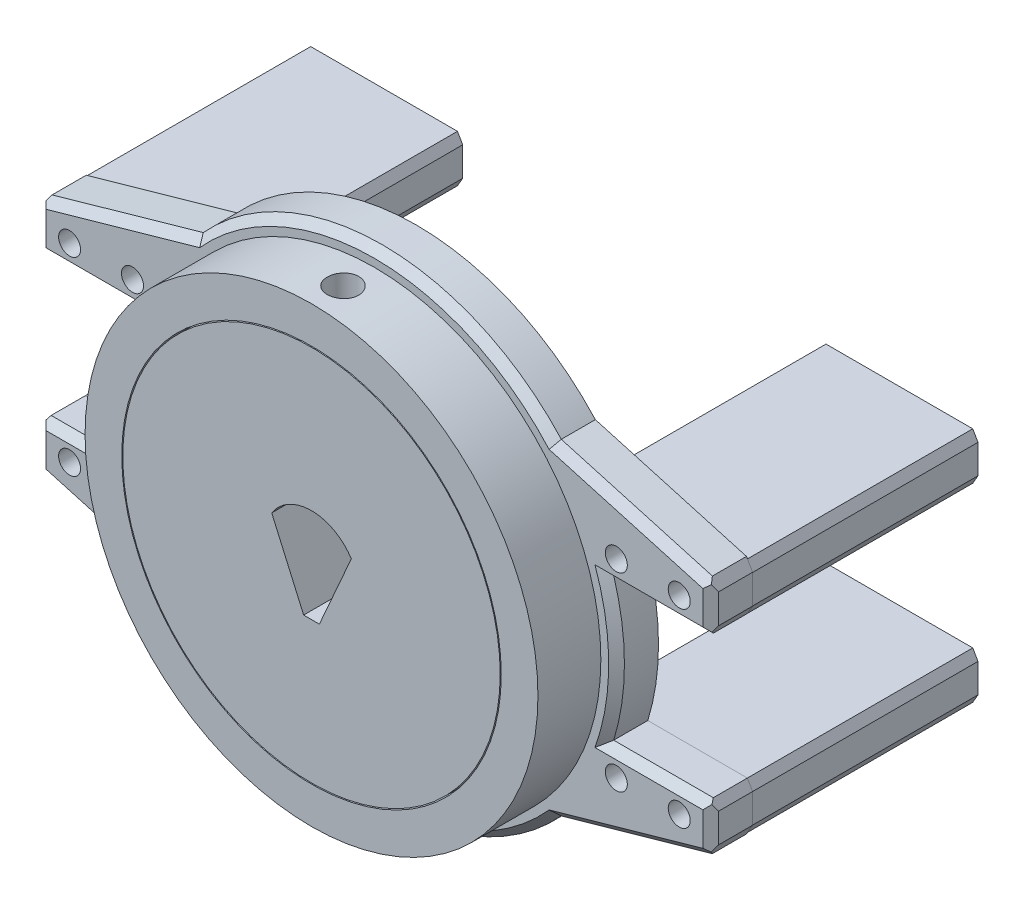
SolidWorks part; units mm, degrees
other "Holder"
other "Die" parameters "D2"=10.3654, "D4"=73.0293, "D1"=11.373, "D3"=41.0446, "D5"=28, "D6"=60.0193, "D7"=4
ref_plane "Top Plane" through (0, 0, 0) normal (0, 0, 1) x (1, 0, 0)
ref_plane "Front Plane" through (0, 0, 0) normal (0, 1, 0) x (1, 0, 0)
ref_plane "Right Plane" through (0, 0, 0) normal (1, 0, 0) x (0, 0, -1)
sketch "Sketch2" plane through (0, 0, 0) normal (0, 0, 1) x (1, 0, 0)
  line L0 (-3.8311, 0) -> (3.8311, 0) construction
  line L1 (0, 0) -> (0, 9) construction
  line L2 (0, 0) -> (-7.5919, 4.8335) construction
  line L6 (0, 0) -> (7.5919, 4.8335) construction
  line L7 (-7.5919, 4.8335) -> (-1.5, -9)
  line L8 (-1.5, -9) -> (1.5, -9)
  line L9 (1.5, -9) -> (7.5919, 4.8335)
  line L10 (0, 0) -> (0, -9) construction
  circle A0 centre (0, 0) radius 5 construction
  circle A2 centre (0, 0) radius 36
  arc A3 (0, 9) -> (7.5919, 4.8335) centre (0, 0) cw
  arc A4 (-7.5919, 4.8335) -> (0, 9) centre (0, 0) cw
  point P3 (0, -9)
  point P6 (0, 0)
  point P11 (28.1431, -6.9977)
  point P12 (28.1374, -7.0206)
  point P16 (0, 0)
  point P17 (26.8284, -11.0108)
extrude "Boss-Extrude1" add sketch "Sketch2" along normal blind 12
sketch "Sketch3" plane through (0, 0, 0) normal (0, 1, 0) x (1, 0, 0)
  line L0 (-36, -12) -> (36, -12) construction
  line L1 (36, 0) -> (-36, 0) construction
  line L2 (-36, -12) -> (36, -12) construction
  line L3 (36, 0) -> (-36, 0) construction
  line L4 (0, 0) -> (0, -12) construction
  circle A0 centre (0, -6) radius 2.6
  point P8 (0, -12)
extrude "Cut-Extrude1" cut sketch "Sketch3" along normal up to surface (36 mm away)
sketch "Sketch4" plane through (0, 0, 0) normal (0, 0, -1) x (-1, 0, 0)
  circle A0 centre (0, 0) radius 36 construction
  circle A1 centre (0, 0) radius 36
  circle A2 centre (0, 0) radius 36.2
  circle A3 centre (0, 0) radius 43.2
extrude "Boss-Extrude2" add sketch "Sketch4" against normal up to surface (12 mm away) separate body contours A3 A2
sketch "Sketch5" plane through (0, 0, 0) normal (0, 1, 0) x (1, 0, 0)
  circle A0 centre (0, -6) radius 2.6 construction
  circle A1 centre (0, -6) radius 2.6 construction
  circle A2 centre (0, -6) radius 3
extrude "Cut-Extrude2" cut sketch "Sketch5" along normal up to surface (43.2 mm away)
sketch "Sketch6" plane through (0, 0, 0) normal (0, 0, -1) x (-1, 0, 0)
  line L0 (42.6, 0) -> (-42.6, 0) construction
  line L1 (42.6, 0) -> (42.6, -13.6) construction
  line L2 (42.6, 0) -> (42.6, 13.6) construction
  line L3 (42.6, -13.6) -> (44.1529, -13.6) construction
  line L4 (42.6, 13.6) -> (44.1529, 13.6) construction
  line L5 (44.1529, -13.6) -> (64.1529, -13.6)
  line L6 (64.1529, -13.6) -> (64.1529, -22.6)
  line L7 (64.1529, -22.6) -> (34.1529, -31.113)
  line L8 (44.1529, 13.6) -> (64.1529, 13.6)
  line L9 (64.1529, 13.6) -> (64.1529, 22.6)
  line L10 (64.1529, 22.6) -> (34.1529, 31.113)
  line L11 (34.1529, -31.113) -> (34.1529, 31.113) construction
  line L12 (0, -58.262) -> (0, 58.262) construction
  line L13 (-64.1529, 22.6) -> (-34.1529, 31.113)
  line L14 (-64.1529, 13.6) -> (-64.1529, 22.6)
  line L15 (-44.1529, 13.6) -> (-64.1529, 13.6)
  line L16 (-44.1529, -13.6) -> (-64.1529, -13.6)
  line L17 (-64.1529, -13.6) -> (-64.1529, -22.6)
  line L18 (-64.1529, -22.6) -> (-34.1529, -31.113)
  arc A0 (34.1529, 31.113) -> (-34.1529, 31.113) centre (0, 0) ccw
  arc A1 (-44.1529, 13.6) -> (-44.1529, -13.6) centre (0, 0) ccw
  arc A2 (-34.1529, -31.113) -> (34.1529, -31.113) centre (0, 0) ccw
  circle A3 centre (0, 0) radius 46.2
  arc A4 (44.1529, -13.6) -> (44.1529, 13.6) centre (0, 0) ccw
  circle A7 centre (0, 0) radius 32
  circle A8 centre (0, 0) radius 32
  point P3 (0, 0)
  point P19 (0, 0)
extrude "Boss-Extrude3" add sketch "Sketch6" along normal blind 8
chamfer "Chamfer1" distance 1.5 angle 45 16 edges at (-49.1529, 26.8565, 0) (0, 46.2, 0) (49.1529, 26.8565, 0) (64.1529, 18.1, 0) (54.1529, 13.6, 0) (46.2, 0, 0) (54.1529, -13.6, 0) (64.1529, -18.1, 0) (49.1529, -26.8565, 0) (0, -46.2, 0) (-49.1529, -26.8565, 0) (-64.1529, -18.1, 0) (-54.1529, -13.6, 0) (-46.2, 0, 0) (-54.1529, 13.6, 0) (-64.1529, 18.1, 0)
sketch "Sketch7" plane through (0, 0, -8) normal (0, 0, -1) x (-1, 0, 0)
  line L0 (-64.1529, 13.6) -> (-44.1529, 13.6) construction
  line L1 (-63.1529, 22.6) -> (-35.1529, 22.6)
  line L2 (-64.1529, 20.8679) -> (-64.1529, 15.3321)
  line L3 (-63.1529, 13.6) -> (-35.1529, 13.6)
  line L4 (-34.1529, 20.8679) -> (-34.1529, 15.3321)
  line L5 (-64.1529, 22.6) -> (-64.1529, 13.6) construction
  line L6 (-64.1529, 22.6) -> (-64.1529, 13.6) construction
  line L7 (-64.1529, 22.6) -> (-6.4522, 22.6) construction
  line L8 (-64.1529, 18.1) -> (-34.1529, 18.1) construction
  line L9 (-64.1529, 20.8679) -> (-63.1529, 22.6)
  line L10 (-64.1529, 15.3321) -> (-63.1529, 13.6)
  line L11 (-35.1529, 13.6) -> (-34.1529, 15.3321)
  line L12 (-35.1529, 22.6) -> (-34.1529, 20.8679)
  line L13 (0, 54.9745) -> (0, -54.9745) construction
  line L14 (-78.161, 0) -> (78.161, 0) construction
  line L15 (35.1529, 13.6) -> (34.1529, 15.3321)
  line L16 (34.1529, 20.8679) -> (34.1529, 15.3321)
  line L17 (35.1529, 22.6) -> (34.1529, 20.8679)
  line L18 (63.1529, 13.6) -> (35.1529, 13.6)
  line L19 (64.1529, 15.3321) -> (63.1529, 13.6)
  line L20 (64.1529, 20.8679) -> (63.1529, 22.6)
  line L21 (63.1529, 22.6) -> (35.1529, 22.6)
  line L22 (64.1529, 20.8679) -> (64.1529, 15.3321)
  line L23 (-64.1529, -20.8679) -> (-63.1529, -22.6)
  line L24 (-64.1529, -20.8679) -> (-64.1529, -15.3321)
  line L25 (-64.1529, -15.3321) -> (-63.1529, -13.6)
  line L26 (-63.1529, -13.6) -> (-35.1529, -13.6)
  line L27 (-35.1529, -13.6) -> (-34.1529, -15.3321)
  line L28 (-34.1529, -20.8679) -> (-34.1529, -15.3321)
  line L29 (-35.1529, -22.6) -> (-34.1529, -20.8679)
  line L30 (-63.1529, -22.6) -> (-35.1529, -22.6)
  line L31 (64.1529, -20.8679) -> (64.1529, -15.3321)
  line L32 (63.1529, -22.6) -> (35.1529, -22.6)
  line L33 (64.1529, -20.8679) -> (63.1529, -22.6)
  line L34 (64.1529, -15.3321) -> (63.1529, -13.6)
  line L35 (63.1529, -13.6) -> (35.1529, -13.6)
  line L36 (35.1529, -22.6) -> (34.1529, -20.8679)
  line L37 (34.1529, -20.8679) -> (34.1529, -15.3321)
  line L38 (35.1529, -13.6) -> (34.1529, -15.3321)
  point P0 (-64.1529, 22.6)
  point P1 (-34.1529, 13.6)
  point P2 (-64.1529, 13.6)
  point P3 (-34.1529, 22.6)
  point P21 (-34.1529, 18.1)
  point P23 (-64.1529, 18.1)
  point P24 (0, 0)
  point P30 (0, 0)
  dimension "D1" = 30
  dimension "D2" = 1
  dimension "D3" = 60
  dimension "D4" = 1
  dimension "D5" = 60
  dimension "D6" = 1
  dimension "D7" = 60
  dimension "D8" = 1
  dimension "D9" = 60
extrude "Boss-Extrude4" add sketch "Sketch7" along normal blind 43 separate body
chamfer "Chamfer3" distance 1 angle 60 2 edges at (-64.1529, 13.6, -4.75) (64.1529, -13.6, -4.75)
chamfer "Chamfer4" distance 1.7 angle 30 4 edges at (-64.1529, 22.6, -4.75) (-64.1529, -13.6, -4.75) (64.1529, 13.6, -4.75) (64.1529, -22.6, -4.75)
chamfer "Chamfer5" distance 1.7 angle 30 1 edges at (-64.1529, -22.6, -4.75)
chamfer "Chamfer6" distance 1.7 angle 30 1 edges at (64.1529, 22.6, -4.75)
sketch "Sketch8" plane through (0, 0, -8) normal (0, 0, -1) x (-1, 0, 0)
  line L0 (64.1529, -20.8679) -> (63.1529, -22.6) construction
  line L1 (63.1529, -22.6) -> (35.1529, -22.6) construction
  line L2 (35.1529, -22.6) -> (34.1529, -20.8679) construction
  line L3 (34.1529, -20.8679) -> (34.1529, -15.3321) construction
  line L4 (34.1529, -15.3321) -> (35.1529, -13.6) construction
  line L5 (35.1529, -13.6) -> (63.1529, -13.6) construction
  line L6 (63.1529, -13.6) -> (64.1529, -15.3321) construction
  line L7 (64.1529, -15.3321) -> (64.1529, -20.8679) construction
  line L8 (63.1529, 13.6) -> (35.1529, 13.6) construction
  line L9 (35.1529, 13.6) -> (34.1529, 15.3321) construction
  line L10 (34.1529, 15.3321) -> (34.1529, 20.8679) construction
  line L11 (34.1529, 20.8679) -> (35.1529, 22.6) construction
  line L12 (35.1529, 22.6) -> (63.1529, 22.6) construction
  line L13 (63.1529, 22.6) -> (64.1529, 20.8679) construction
  line L14 (64.1529, 20.8679) -> (64.1529, 15.3321) construction
  line L15 (64.1529, 15.3321) -> (63.1529, 13.6) construction
  line L16 (-64.1529, 20.8679) -> (-63.1529, 22.6) construction
  line L17 (-63.1529, 22.6) -> (-35.1529, 22.6) construction
  line L18 (-35.1529, 22.6) -> (-34.1529, 20.8679) construction
  line L19 (-34.1529, 20.8679) -> (-34.1529, 15.3321) construction
  line L20 (-34.1529, 15.3321) -> (-35.1529, 13.6) construction
  line L21 (-35.1529, 13.6) -> (-63.1529, 13.6) construction
  line L22 (-63.1529, 13.6) -> (-64.1529, 15.3321) construction
  line L23 (-64.1529, 15.3321) -> (-64.1529, 20.8679) construction
  line L24 (-64.1529, -20.8679) -> (-64.1529, -15.3321) construction
  line L25 (-64.1529, -15.3321) -> (-63.1529, -13.6) construction
  line L26 (-63.1529, -13.6) -> (-35.1529, -13.6) construction
  line L27 (-35.1529, -13.6) -> (-34.1529, -15.3321) construction
  line L28 (-34.1529, -15.3321) -> (-34.1529, -20.8679) construction
  line L29 (-34.1529, -20.8679) -> (-35.1529, -22.6) construction
  line L30 (-35.1529, -22.6) -> (-63.1529, -22.6) construction
  line L31 (-63.1529, -22.6) -> (-64.1529, -20.8679) construction
  line L32 (64.1529, -20.8679) -> (63.1529, -22.6) construction
  line L33 (63.1529, -22.6) -> (35.1529, -22.6) construction
  line L34 (35.1529, -22.6) -> (34.1529, -20.8679) construction
  line L35 (34.1529, -20.8679) -> (34.1529, -15.3321) construction
  line L36 (34.1529, -15.3321) -> (35.1529, -13.6) construction
  line L37 (35.1529, -13.6) -> (63.1529, -13.6) construction
  line L38 (63.1529, -13.6) -> (64.1529, -15.3321) construction
  line L39 (64.1529, -15.3321) -> (64.1529, -20.8679) construction
  line L40 (63.1529, 13.6) -> (35.1529, 13.6) construction
  line L41 (35.1529, 13.6) -> (34.1529, 15.3321) construction
  line L42 (34.1529, 15.3321) -> (34.1529, 20.8679) construction
  line L43 (34.1529, 20.8679) -> (35.1529, 22.6) construction
  line L44 (35.1529, 22.6) -> (63.1529, 22.6) construction
  line L45 (63.1529, 22.6) -> (64.1529, 20.8679) construction
  line L46 (64.1529, 20.8679) -> (64.1529, 15.3321) construction
  line L47 (64.1529, 15.3321) -> (63.1529, 13.6) construction
  line L48 (-64.1529, 20.8679) -> (-63.1529, 22.6) construction
  line L49 (-63.1529, 22.6) -> (-35.1529, 22.6) construction
  line L50 (-35.1529, 22.6) -> (-34.1529, 20.8679) construction
  line L51 (-34.1529, 20.8679) -> (-34.1529, 15.3321) construction
  line L52 (-34.1529, 15.3321) -> (-35.1529, 13.6) construction
  line L53 (-35.1529, 13.6) -> (-63.1529, 13.6) construction
  line L54 (-63.1529, 13.6) -> (-64.1529, 15.3321) construction
  line L55 (-64.1529, 15.3321) -> (-64.1529, 20.8679) construction
  line L56 (-64.1529, -20.8679) -> (-64.1529, -15.3321) construction
  line L57 (-64.1529, -15.3321) -> (-63.1529, -13.6) construction
  line L58 (-63.1529, -13.6) -> (-35.1529, -13.6) construction
  line L59 (-35.1529, -13.6) -> (-34.1529, -15.3321) construction
  line L60 (-34.1529, -15.3321) -> (-34.1529, -20.8679) construction
  line L61 (-34.1529, -20.8679) -> (-35.1529, -22.6) construction
  line L62 (-35.1529, -22.6) -> (-63.1529, -22.6) construction
  line L63 (-63.1529, -22.6) -> (-64.1529, -20.8679) construction
  line L64 (-46.1529, 18.1) -> (-34.1529, 18.1) construction
  line L65 (-46.1529, -18.1) -> (-34.1529, -18.1) construction
  line L66 (34.1529, 18.1) -> (46.1529, 18.1) construction
  line L67 (34.1529, -18.1) -> (46.1529, -18.1) construction
  line L68 (-64.1529, 18.1) -> (-58.1529, 18.1) construction
  line L69 (-64.1529, -18.1) -> (-58.1529, -18.1) construction
  line L70 (64.1529, 18.1) -> (58.1529, 18.1) construction
  line L71 (64.1529, -18.1) -> (58.1529, -18.1) construction
  circle A0 centre (46.1529, -18.1) radius 2.1
  circle A1 centre (46.1529, 18.1) radius 2.1
  circle A2 centre (-46.1529, -18.1) radius 2.1
  circle A3 centre (-46.1529, 18.1) radius 2.1
  circle A4 centre (-58.1529, 18.1) radius 2.1
  circle A5 centre (-58.1529, -18.1) radius 2.1
  circle A6 centre (58.1529, -18.1) radius 2.1
  circle A7 centre (58.1529, 18.1) radius 2.1
  dimension "D1" = 4.2
  dimension "D2" = 12
  dimension "D3" = 6
extrude "Cut-Extrude3" cut sketch "Sketch8" against normal up to surface (8 mm away)
sketch "Sketch9" plane through (0, 0, -8) normal (0, 0, 1) x (1, 0, 0)
  circle A0 centre (58.1529, -18.1) radius 2.1 construction
  circle A1 centre (58.1529, 18.1) radius 2.1 construction
  circle A2 centre (46.1529, 18.1) radius 2.1 construction
  circle A3 centre (46.1529, -18.1) radius 2.1 construction
  circle A4 centre (-46.1529, 18.1) radius 2.1 construction
  circle A5 centre (-58.1529, 18.1) radius 2.1 construction
  circle A6 centre (-58.1529, -18.1) radius 2.1 construction
  circle A7 centre (-46.1529, -18.1) radius 2.1 construction
  circle A8 centre (58.1529, -18.1) radius 2.1
  circle A9 centre (58.1529, 18.1) radius 2.1
  circle A10 centre (46.1529, 18.1) radius 2.1
  circle A11 centre (46.1529, -18.1) radius 2.1
  circle A12 centre (-46.1529, 18.1) radius 2.1
  circle A13 centre (-58.1529, 18.1) radius 2.1
  circle A14 centre (-58.1529, -18.1) radius 2.1
  circle A15 centre (-46.1529, -18.1) radius 2.1
  circle A16 centre (58.1529, -18.1) radius 1.65
  circle A17 centre (58.1529, 18.1) radius 1.65
  circle A18 centre (46.1529, 18.1) radius 1.65
  circle A19 centre (46.1529, -18.1) radius 1.65
  circle A20 centre (-46.1529, 18.1) radius 1.65
  circle A21 centre (-58.1529, 18.1) radius 1.65
  circle A22 centre (-58.1529, -18.1) radius 1.65
  circle A23 centre (-46.1529, -18.1) radius 1.65
  dimension "D1" = 0.45
extrude "Cut-Extrude4" cut sketch "Sketch9" against normal blind 25 contours A21 | A20 | A22 | A23 | A18 | A17 | A16 | A19
equation "\"bore-id\"= 10mm"
equation "\"bore-offset\" = 4.00mm"
equation "\"D2@Sketch2\"=\"bore-id\""
equation "\"bore-wall\" = 5"
equation "\"D4@Sketch2\"= \"max-id\""
equation "\"max-id\" = 72"
equation "\"D1@Sketch2\"=\"bore-id\"/2 +\"bore-offset\""
equation "\"bore-width\"= 3"
equation "\"D3@Sketch2\"=\"bore-width\""
equation "\"die-boltclearance\"= 5.2"
equation "\"bolt-wall\"= 3.4"
equation "\"D1@Boss-Extrude1\"= \"die-boltclearance\" + 2 * \"bolt-wall\""
equation "\"D1@Sketch3\"=\"die-boltclearance\""
equation "\"die-wall\"= 7"
equation "\"D2@Sketch4\"= \"die-wall\""
equation "\"threadsert-diameter\"= 6"
equation "\"D1@Sketch5\"=\"threadsert-diameter\""
equation "\"D7@Sketch6\"= \"bore-offset\""
equation "\"chuckface-distance\"= 57"
equation "\"dieholder-thickness\"= 8"
equation "\"D1@Boss-Extrude3\"= \"dieholder-thickness\""
equation "\"D1@Boss-Extrude4\"= \"chuckface-distance\" - \"dieholder-thickness\" - \"bolt-wall\" - \"die-boltclearance\" / 2"
equation "\"drill-depth\"= 25"
equation "\"D1@Cut-Extrude4\"= \"drill-depth\""
